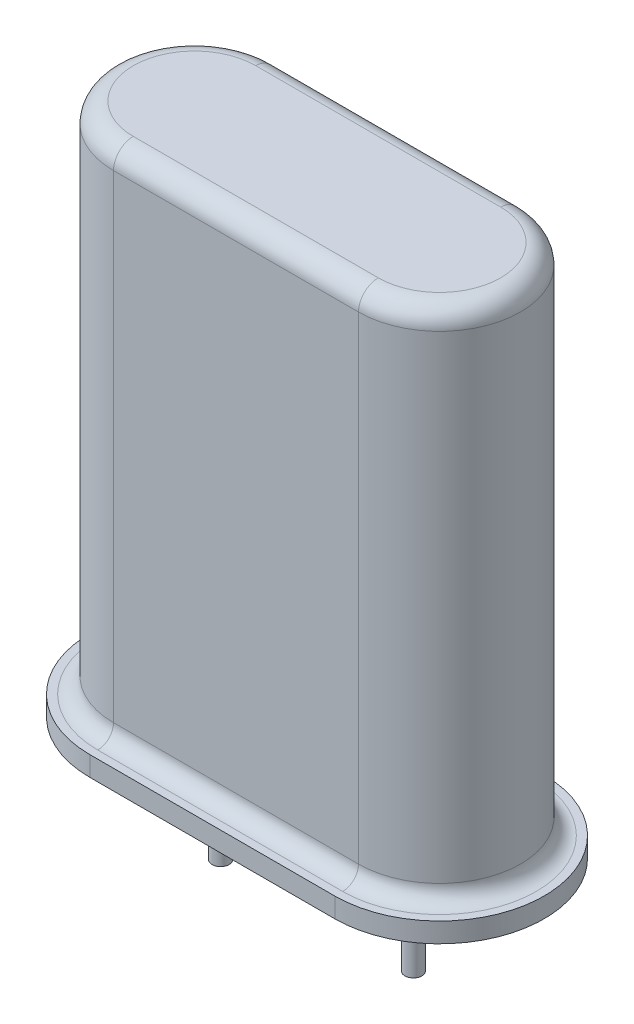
SolidWorks part; units mm, degrees
ref_plane "Front" through (0, 0, 0) normal (0, 0, 1) x (1, 0, 0)
ref_plane "Top" through (0, 0, 0) normal (0, 1, 0) x (1, 0, 0)
ref_plane "Right" through (0, 0, 0) normal (1, 0, 0) x (0, 0, -1)
sketch "Эскиз2" plane through (0, 0, 0) normal (0, 0, 1) x (1, 0, 0)
  line L0 (-2.44, -2.5) -> (-2.225, -2.5)
  line L1 (-2.225, -2.5) -> (-2.225, 0)
  line L2 (-2.225, 0) -> (-2.1273, 0)
  line L3 (-2.44, -2.5) -> (-2.44, 0) construction
  line L4 (-1.74, 0.3) -> (-2.44, 0.3)
  line L5 (-2.44, 0.3) -> (-2.44, -2.5)
  arc A0 (-2.1273, 0) -> (-1.74, 0.3) centre (-2.1273, 0.4) ccw
  dimension "D4" = 0.4
  dimension "D1" = 0.43
  dimension "D2" = 2.5
  dimension "D3" = 0.3
  dimension "D5" = 1.4
  dimension "D6" = 2.44
revolve "Повернуть1" add sketch "Эскиз2" angle 360 about L3
sketch "Эскиз3" plane through (0, 0.3, 0) normal (0, 1, 0) x (-1, 0, 0)
  line L0 (3.1, 0) -> (-3.1, 0) construction
  line L1 (3.1, 2.65) -> (-3.1, 2.65)
  line L2 (3.1, -2.65) -> (-3.1, -2.65)
  line L3 (0, -2.65) -> (0, 2.65) construction
  arc A0 (3.1, 2.65) -> (3.1, -2.65) centre (3.1, 0) cw
  arc A1 (-3.1, 2.65) -> (-3.1, -2.65) centre (-3.1, 0) ccw
  dimension "D1" = 11.5
  dimension "D2" = 5.3
extrude "Вытянуть1" add sketch "Эскиз3" along normal blind 0.5
sketch "Эскиз4" plane through (0, 0.8, 0) normal (0, 1, 0) x (-1, 0, 0)
  line L4 (3.1, 2.05) -> (-3.1, 2.05)
  line L5 (-3.1, -2.05) -> (3.1, -2.05)
  line L6 (3.1, 2.05) -> (-3.1, 2.05)
  line L7 (-3.1, -2.05) -> (3.1, -2.05)
  arc A4 (-3.1, 2.05) -> (-3.1, -2.05) centre (-3.1, 0) ccw
  arc A5 (3.1, -2.05) -> (3.1, 2.05) centre (3.1, 0) ccw
  arc A6 (-3.1, 2.05) -> (-3.1, -2.05) centre (-3.1, 0) ccw
  arc A7 (3.1, -2.05) -> (3.1, 2.05) centre (3.1, 0) ccw
  dimension "D2" = 10.3
  dimension "D3" = 4.1
  dimension "D1" = 0.6
extrude "Вытянуть2" add sketch "Эскиз4" along normal offset from surface (13 mm away) 13.5
mirror "Зеркальное отражение1" about plane through (0, 0, 0) normal (1, 0, 0) of "Повернуть1"
fillet "Скругление1" radius 0.4 4 edges at (-5.15, 0.8, 0) (0, 0.8, -2.05) (5.15, 0.8, 0) (0, 0.8, 2.05)
fillet "Скругление2" radius 0.5 4 edges at (5.15, 13.8, 0) (0, 13.8, -2.05) (-5.15, 13.8, 0) (0, 13.8, 2.05)
